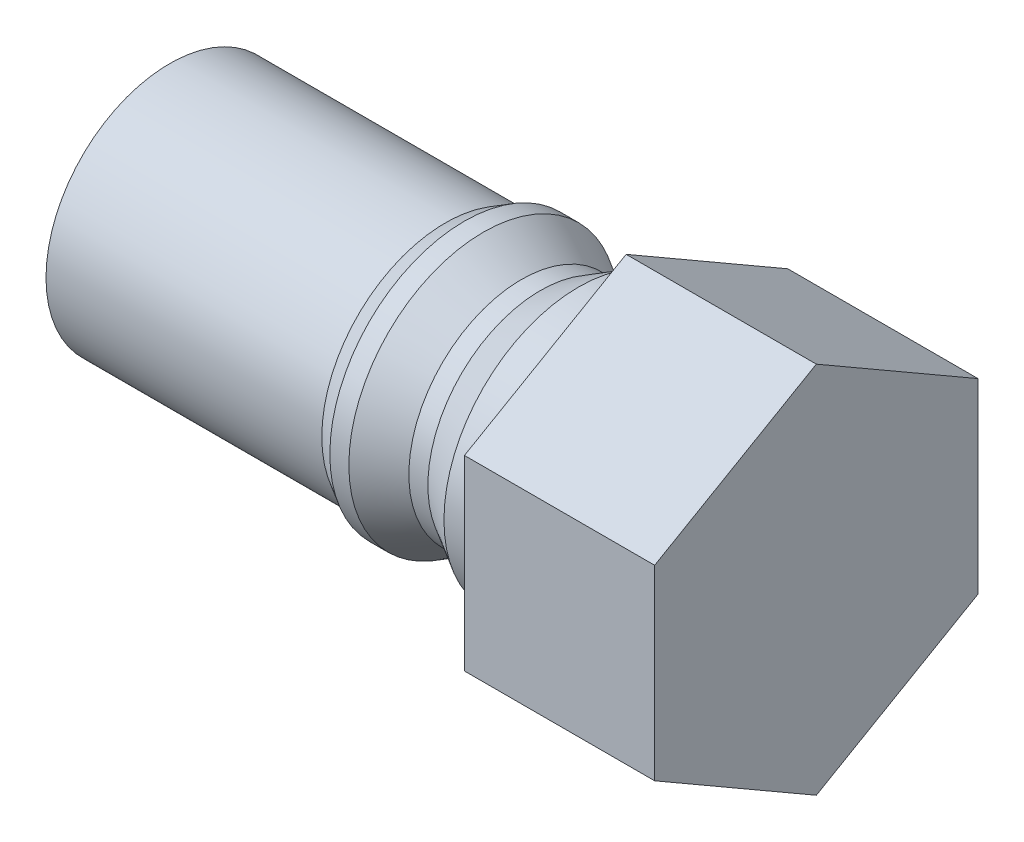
SolidWorks part; units mm, degrees
ref_plane "Alzado" through (0, 0, 0) normal (0, 0, 1) x (1, 0, 0)
ref_plane "Planta" through (0, 0, 0) normal (0, 1, 0) x (1, 0, 0)
ref_plane "Vista lateral" through (0, 0, 0) normal (1, 0, 0) x (0, 0, -1)
sketch "Croquis1" plane through (0, 0, 0) normal (0, 0, 1) x (1, 0, 0)
  line L0 (0, 0) -> (24, 0) construction
  line L1 (0, 0) -> (0, 6.5)
  line L2 (0, 6.5) -> (14.5, 6.5)
  line L3 (14.5, 6.5) -> (15.5, 7.0774)
  line L4 (15.5, 7.0774) -> (16.5, 7.0774)
  line L5 (16, 7.0774) -> (16, 0) construction
  line L6 (17.5, 6.5) -> (16.5, 7.0774)
  line L7 (17.5, 6.5) -> (18.5, 5.9226)
  line L8 (18.5, 5.9226) -> (19.5, 5.9226)
  line L9 (19, 5.9226) -> (19, 0) construction
  line L10 (20.5, 6.5) -> (19.5, 5.9226)
  line L11 (20.5, 6.5) -> (21.5, 7.0774)
  line L12 (21.5, 7.0774) -> (24, 7.0774)
  line L13 (24, 7.0774) -> (24, 0)
  line L14 (24, 0) -> (0, 0)
  dimension "D1" = 13
  dimension "D2" = 14.5
  dimension "D3" = 1
  dimension "D4" = 1
  dimension "D5" = 150
  dimension "D6" = 1
  dimension "D7" = 1
  dimension "D8" = 2.5
revolve "Revolución1" add sketch "Croquis1" angle 360 about L14
sketch "Croquis4" plane through (24, 0, 0) normal (1, 0, 0) x (0, 0, -1)
  line L1 (0, 9.815) -> (-8.5, 4.9075)
  line L2 (-8.5, 4.9075) -> (-8.5, -4.9075)
  line L3 (-8.5, -4.9075) -> (0, -9.815)
  line L4 (0, -9.815) -> (8.5, -4.9075)
  line L5 (8.5, -4.9075) -> (8.5, 4.9075)
  line L6 (8.5, 4.9075) -> (0, 9.815)
  circle A0 centre (0, 0) radius 8.5 construction
  dimension "D1" = 17
extrude "Saliente-Extruir3" add sketch "Croquis4" along normal blind 10
